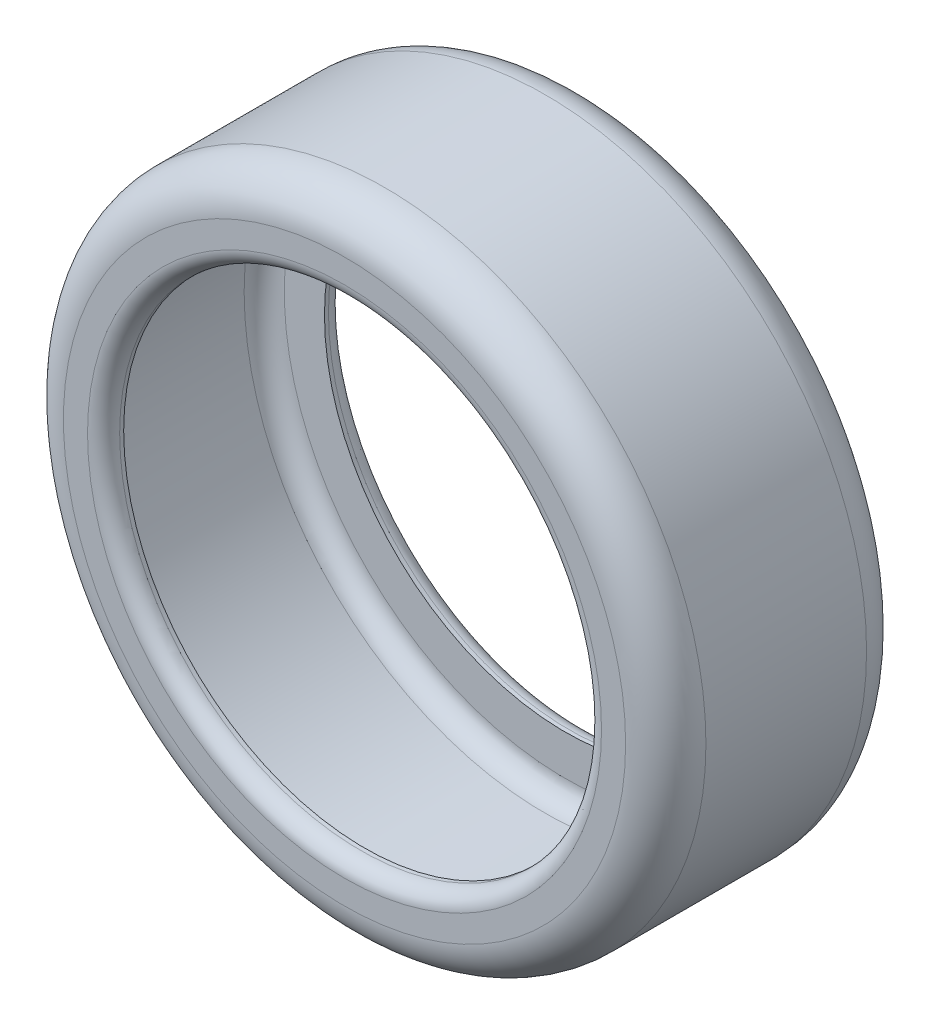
SolidWorks part; units mm, degrees
ref_plane "Front Plane" through (0, 0, 0) normal (0, 0, 1) x (1, 0, 0)
ref_plane "Top Plane" through (0, 0, 0) normal (0, 1, 0) x (1, 0, 0)
ref_plane "Right Plane" through (0, 0, 0) normal (1, 0, 0) x (0, 0, -1)
sketch "Sketch3" plane through (0, 0, 0) normal (0, 0, 1) x (1, 0, 0)
  circle A0 centre (0, 0) radius 101.6
  circle A1 centre (0, 0) radius 76.2
  dimension "D1" = 203.2
  dimension "D2" = 152.4
extrude "Boss-Extrude1" add sketch "Sketch3" along normal blind 76.2
fillet "Fillet1" radius 12.7 2 edges at (101.6, 0, 0) (101.6, 0, 76.2)
fillet "Fillet2" radius 5.08 2 edges at (76.2, 0, 0) (76.2, 0, 76.2)
shell "Shell1" thickness 6.35
